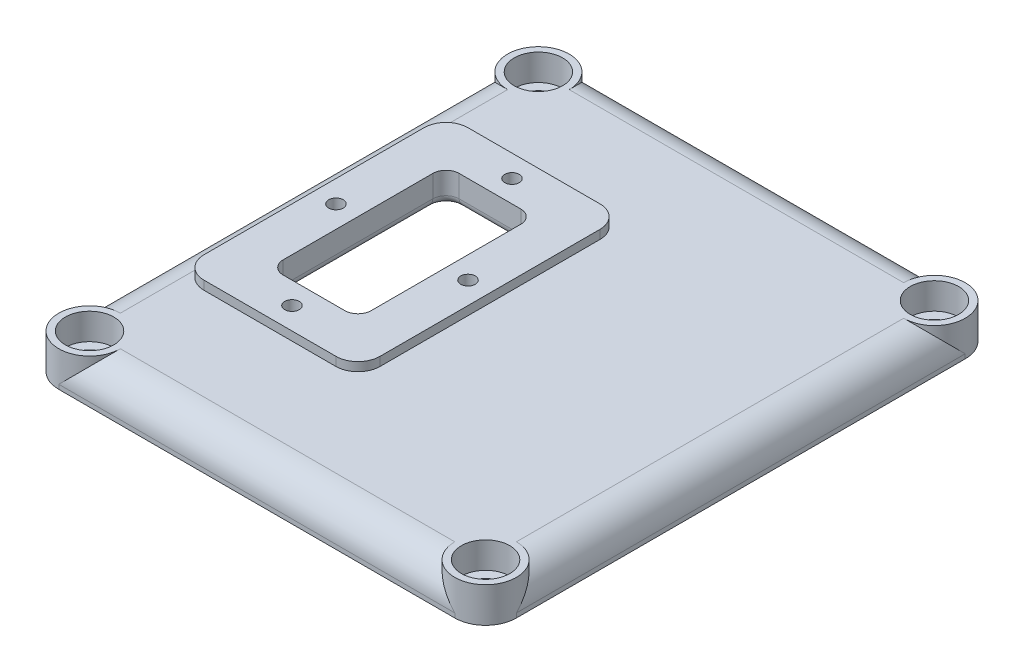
SolidWorks part; units mm, degrees
ref_plane "前视基准面" through (0, 0, 0) normal (0, 0, 1) x (1, 0, 0)
ref_plane "上视基准面" through (0, 0, 0) normal (0, 1, 0) x (1, 0, 0)
ref_plane "右视基准面" through (0, 0, 0) normal (1, 0, 0) x (0, 0, -1)
sketch "草图1" plane through (0, 0, 0) normal (0, 1, 0) x (1, 0, 0)
  line L0 (-83.6421, 0) -> (86.7045, 0) construction
  line L1 (-52, 51) -> (-52, -51)
  line L2 (-45, -58) -> (45, -58)
  line L3 (52, -51) -> (52, 51)
  line L4 (-45, 58) -> (45, 58)
  arc A0 (-52, -51) -> (-45, -58) centre (-45, -51) ccw
  arc A1 (45, -58) -> (52, -51) centre (45, -51) ccw
  arc A2 (45, 58) -> (52, 51) centre (45, 51) cw
  arc A3 (-52, 51) -> (-45, 58) centre (-45, 51) cw
  point P10 (-52, 0)
  point P18 (52, 0)
extrude "拉伸1" add sketch "草图1" along normal blind 8
sketch "草图2" plane through (0, 8, 0) normal (0, 1, 0) x (1, 0, 0)
  line L0 (-45, 25) -> (-45, -25)
  line L1 (-40, -30) -> (-10, -30)
  line L2 (-5, -25) -> (-5, 25)
  line L3 (-55.6462, 0) -> (6.7415, 0) construction
  line L4 (-40, 30) -> (-10, 30)
  arc A0 (-45, -25) -> (-40, -30) centre (-40, -25) ccw
  arc A1 (-10, -30) -> (-5, -25) centre (-10, -25) ccw
  arc A2 (-10, 30) -> (-5, 25) centre (-10, 25) cw
  arc A3 (-45, 25) -> (-40, 30) centre (-40, 25) cw
  point P9 (-45, 0)
  point P18 (-5, 0)
extrude "拉伸2" add sketch "草图2" along normal blind 2
sketch "草图3" plane through (0, 0, 0) normal (0, -1, 0) x (1, 0, 0)
  line L0 (-56.1032, 0) -> (58.8455, 0) construction
  line L1 (-45, 51) -> (-45, -51)
  line L2 (-45, -51) -> (45, -51)
  line L3 (45, -51) -> (45, 51)
  line L4 (-45, 51) -> (45, 51)
  point P9 (45, 0)
  point P10 (-45, 0)
extrude "切除-拉伸1" cut sketch "草图3" against normal blind 3
sketch "草图6" plane through (0, 10, 0) normal (0, 1, 0) x (1, 0, 0)
  line L0 (-35, 17) -> (-35, -17)
  line L1 (-32, -20) -> (-18, -20)
  line L2 (-15, -17) -> (-15, 17)
  line L3 (-42.0843, 0) -> (-7.6506, 0) construction
  line L4 (-32, 20) -> (-18, 20)
  arc A0 (-35, -17) -> (-32, -20) centre (-32, -17) ccw
  arc A1 (-18, -20) -> (-15, -17) centre (-18, -17) ccw
  arc A2 (-18, 20) -> (-15, 17) centre (-18, 17) cw
  arc A3 (-35, 17) -> (-32, 20) centre (-32, 17) cw
  point P8 (-35, 0)
  point P17 (-15, 0)
extrude "切除-拉伸2" cut sketch "草图6" against normal through all
fillet "圆角1" radius 7 8 edges at (-49.9497, 8, -55.9497) (0, 8, -58) (49.9497, 8, -55.9497) (49.9497, 8, 55.9497) (52, 8, 0) (0, 8, 58) (-49.9497, 8, 55.9497) (-52, 8, 0)
sketch "草图8" plane through (0, 0, 0) normal (0, 1, 0) x (1, 0, 0)
  circle A0 centre (-45, -51) radius 7
  circle A1 centre (45, -51) radius 7
  circle A2 centre (45, 51) radius 7
  circle A3 centre (-45, 51) radius 7
extrude "拉伸3" add sketch "草图8" along normal blind 8
sketch "草图9" plane through (0, 8, 0) normal (0, 1, 0) x (1, 0, 0)
  circle A0 centre (-45, -51) radius 3.25
  circle A1 centre (45, -51) radius 3.25
  circle A2 centre (45, 51) radius 3.25
  circle A3 centre (-45, 51) radius 3.25
extrude "切除-拉伸3" cut sketch "草图9" against normal through all
sketch "草图10" plane through (0, 8, 0) normal (0, 1, 0) x (1, 0, 0)
  circle A0 centre (-45, 51) radius 5.5
  circle A1 centre (45, 51) radius 5.5
  circle A2 centre (-45, -51) radius 5.5
  circle A3 centre (45, -51) radius 5.5
extrude "切除-拉伸4" cut sketch "草图10" against normal blind 6
fillet "圆角2" radius 2 16 edges at (-40.0503, 3, -46.0503) (40.0503, 3, -46.0503) (-40.0503, 3, 46.0503) (40.0503, 3, 46.0503) (0, 3, -51) (45, 3, 0) (0, 3, 51) (-45, 3, 0) (-15.8787, 3, 19.1213) (-15, 3, 0) (-15.8787, 3, -19.1213) (-25, 3, -20) (-34.1213, 3, -19.1213) (-35, 3, 0) (-34.1213, 3, 19.1213) (-25, 3, 20)
sketch "草图12" plane through (0, 10, 0) normal (0, 1, 0) x (1, 0, 0)
  point P0 (-25, 25)
  point P1 (-10, 0)
  point P2 (-40, 0)
  point P3 (-25, -25)
hole_wizard "M4 螺纹孔2" positions "3D草图2" profile "草图13" tap size "M4" standard "GB"
sketch3d "3D草图2"
  point P0 (-40, 10, 0)
  point P3 (-25, 10, -25)
  point P6 (-10, 10, 0)
  point P9 (-25, 10, 25)
sketch "草图13" plane through (-40, 10, 0) normal (1, 0, 0) x (0, 0, 1)
  line L0 (0, 0) -> (0, 10)
  line L1 (0, 10) -> (1.65, 10)
  line L2 (1.65, 10) -> (1.65, 0)
  line L5 (1.65, 0) -> (0, 0)
  line L11 (0, -6.35) -> (0, 107.95) construction
  dimension "籵謂蹟恇謂郰芛眻噤" = 3.3
  dimension "籵謂蹟恇謂郰芛旮僅" = 10
